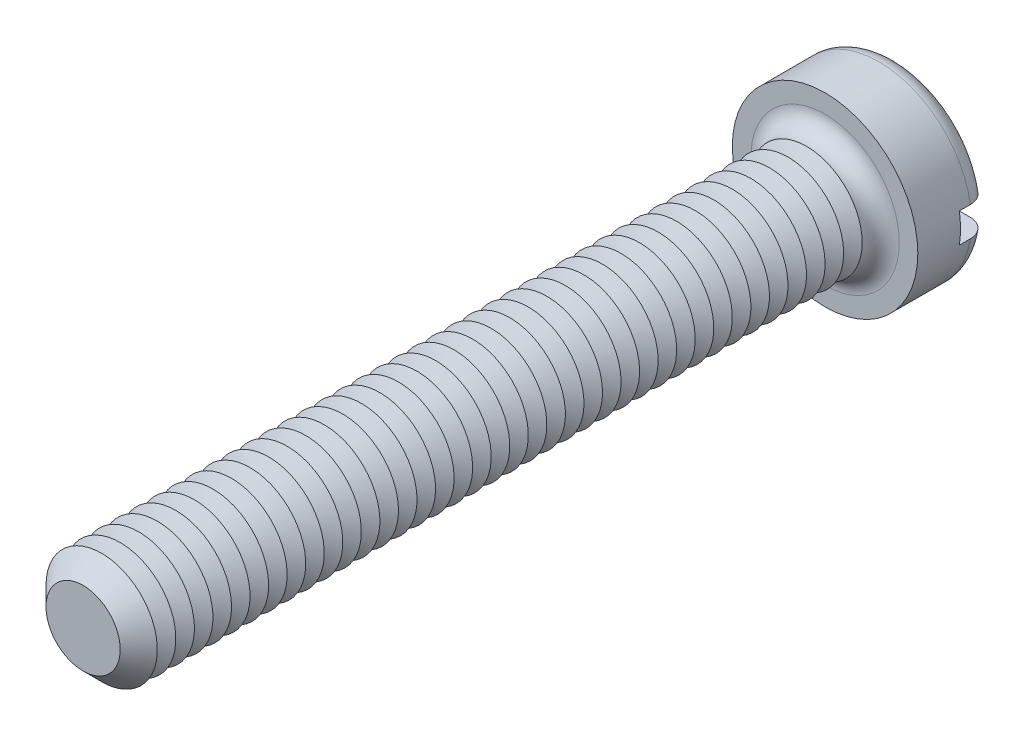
SolidWorks part; units mm, degrees
ref_plane "Front Plane" through (0, 0, 0) normal (0, 0, 1) x (1, 0, 0)
ref_plane "Top Plane" through (0, 0, 0) normal (0, 1, 0) x (1, 0, 0)
ref_plane "Right Plane" through (0, 0, 0) normal (1, 0, 0) x (0, 0, -1)
sketch "Sketch3" plane through (0, 0, 0) normal (0, 0, 1) x (1, 0, 0)
  circle A0 centre (0, 0) radius 5
  dimension "D1" = 10
extrude "Boss-Extrude2" add sketch "Sketch3" against normal blind 3.9
sketch "Sketch4" plane through (0, 0, 0) normal (0, 0, 1) x (1, 0, 0)
  circle A0 centre (0, 0) radius 3
  dimension "D1" = 6
extrude "Boss-Extrude3" add sketch "Sketch4" along normal blind 40
fillet "Fillet1" radius 1 2 edges at (5, 0, -3.9) (3, 0, 0)
chamfer "Chamfer1" distance 1 angle 45 1 edges at (3, 0, 40)
sketch "Sketch5" plane through (0, 0, 0) normal (1, 0, 0) x (0, 0, -1)
  line L0 (1.6944, 0) -> (-7.6738, 0) construction
sketch "Sketch6" plane through (0, 0, 0) normal (1, 0, 0) x (0, 0, -1)
  line L0 (-1, 3) -> (-1.5, 2.134)
  line L1 (-1.5, 2.134) -> (-2, 3)
  line L2 (-1, 3) -> (-39, 3) construction
  line L3 (-2, 3) -> (-1, 3)
  dimension "D1" = 1
revolve "Cut-Revolve1" cut sketch "Sketch6" angle 360 about L0
pattern_linear "LPattern1" count 38 spacing 1 along (0, 0, 1) of "Cut-Revolve1"
sketch "Sketch8" plane through (0, 0, -3.9) normal (0, 0, -1) x (-1, 0, 0)
  line L1 (5, -0.8) -> (-5, -0.8)
  line L2 (5, -0.8) -> (5, 0.8)
  line L3 (5, 0.8) -> (-5, 0.8)
  line L4 (-5, -0.8) -> (-5, 0.8)
  line L5 (5, -0.8) -> (-5, 0.8) construction
  line L6 (5, 0.8) -> (-5, -0.8) construction
  point P0 (0, 0)
  dimension "D1" = 10
  dimension "D2" = 1.6
extrude "Cut-Extrude1" cut sketch "Sketch8" against normal blind 1.6
